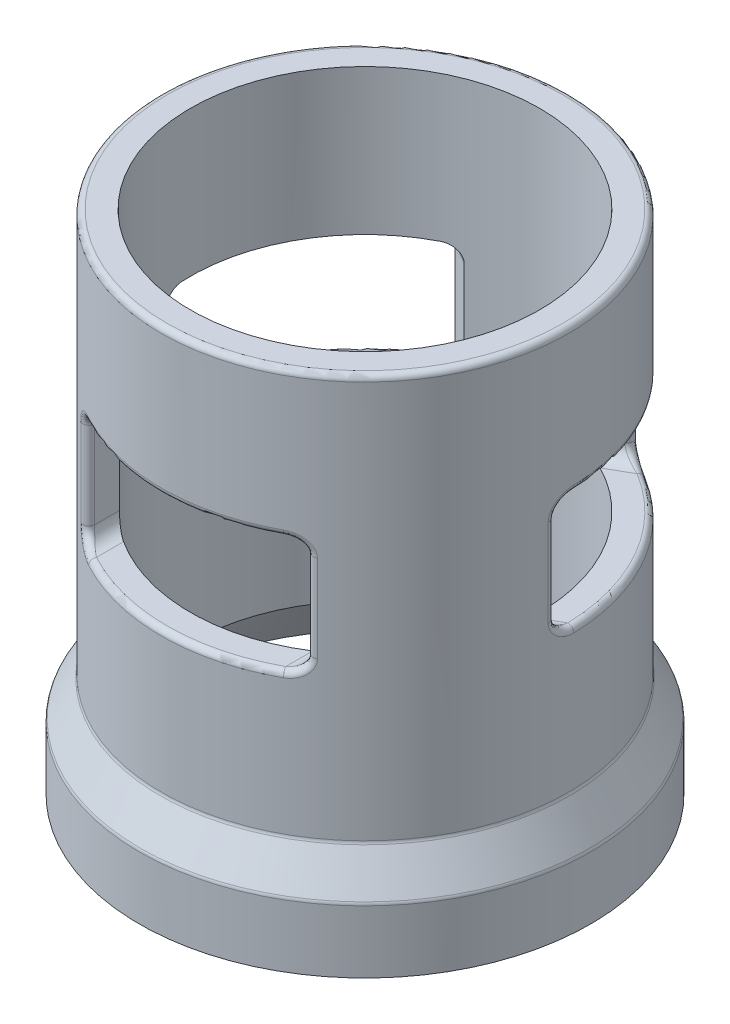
SolidWorks part; units mm, degrees
ref_plane "Front Plane" through (0, 0, 0) normal (0, 0, 1) x (1, 0, 0)
ref_plane "Top Plane" through (0, 0, 0) normal (0, 1, 0) x (1, 0, 0)
ref_plane "Right Plane" through (0, 0, 0) normal (1, 0, 0) x (0, 0, -1)
sketch "Sketch1" plane through (0, 0, 0) normal (0, 0, 1) x (1, 0, 0)
  line L0 (0, 0) -> (0, 35.6667) construction
  line L1 (7.62, 26.289) -> (7.62, 6.096)
  line L3 (8.7199, 4.191) -> (9.8425, 4.191)
  line L5 (9.8425, 4.191) -> (9.8425, 6.985)
  line L6 (9.8425, 6.985) -> (8.89, 8.6348)
  line L7 (8.89, 8.6348) -> (8.89, 26.289)
  line L8 (7.62, 4.191) -> (7.62, 14.605) construction
  line L9 (8.89, 26.289) -> (7.62, 26.289)
  line L10 (8.7199, 4.191) -> (7.62, 6.096)
  line L13 (9.906, 4.191) -> (-9.906, 4.191) construction
  line L14 (9.906, 6.985) -> (-9.906, 6.985) construction
  dimension "D1" = 22.098
  dimension "D2" = 1.27
  dimension "D3" = 30
  dimension "D4" = 1.905
  dimension "D5" = 19.685
revolve "Revolve1" add sketch "Sketch1" angle 360 about L0
sketch "Sketch2" plane through (0, 0, 0) normal (0, 0, 1) x (1, 0, 0)
  line L0 (0, 0) -> (0, 26.289) construction
  line L1 (-4.1275, 19.939) -> (4.1275, 19.939)
  line L2 (-4.7625, 19.304) -> (-4.7625, 15.494)
  line L3 (-4.1275, 14.859) -> (4.1275, 14.859)
  line L4 (4.7625, 19.304) -> (4.7625, 15.494)
  line L5 (7.62, 26.289) -> (-7.62, 26.289) construction
  line L6 (8.89, 26.289) -> (-8.89, 26.289) construction
  arc A0 (-4.7625, 15.494) -> (-4.1275, 14.859) centre (-4.1275, 15.494) ccw
  arc A1 (-4.1275, 19.939) -> (-4.7625, 19.304) centre (-4.1275, 19.304) ccw
  arc A2 (4.1275, 19.939) -> (4.7625, 19.304) centre (4.1275, 19.304) cw
  arc A3 (4.1275, 14.859) -> (4.7625, 15.494) centre (4.1275, 15.494) ccw
  point P15 (-4.7625, 19.939)
  point P18 (4.7625, 19.939)
  point P21 (4.7625, 14.859)
  dimension "D4" = 0.635
  dimension "D1" = 5.08
  dimension "D2" = 9.525
  dimension "D3" = 6.35
extrude "Cut-Extrude1" cut sketch "Sketch2" along normal through all
pattern_circular "CirPattern1" count 3 over 360 about axis through (0, 0, 0) along (0, 1, 0) of "Cut-Extrude1"
fillet "Fillet1" radius 0.254 27 edges at (4.1198, 17.399, -7.8778) (4.3119, 19.7527, -7.7743) (7.699, 19.939, -4.445) (8.8866, 19.6565, 0.2452) (8.8823, 17.399, 0.3711) (8.8888, 15.0374, 0.1436) (7.699, 14.859, -4.445) (4.2068, 15.1792, -7.8316) (4.6557, 15.1415, 7.5734) (4.7625, 17.399, 7.5067) (4.5688, 19.7606, 7.6262) (0, 19.939, 8.89) (-4.6557, 19.6565, 7.5734) (-4.7625, 17.399, 7.5067) (-4.5688, 15.0374, 7.6262) (0, 14.859, 8.89) (0, 26.289, -8.89) (0, 8.6348, -8.89) (-8.8858, 15.1792, 0.2726) (-8.8823, 17.399, 0.3711) (-8.8887, 19.7527, 0.1529) (-7.699, 19.939, -4.445) (-5.149, 18.833, -7.2471) (-4.1198, 17.399, -7.8778) (-4.3721, 14.9928, -7.7406) (-7.699, 14.859, -4.445) (0, 6.985, -9.8425)
